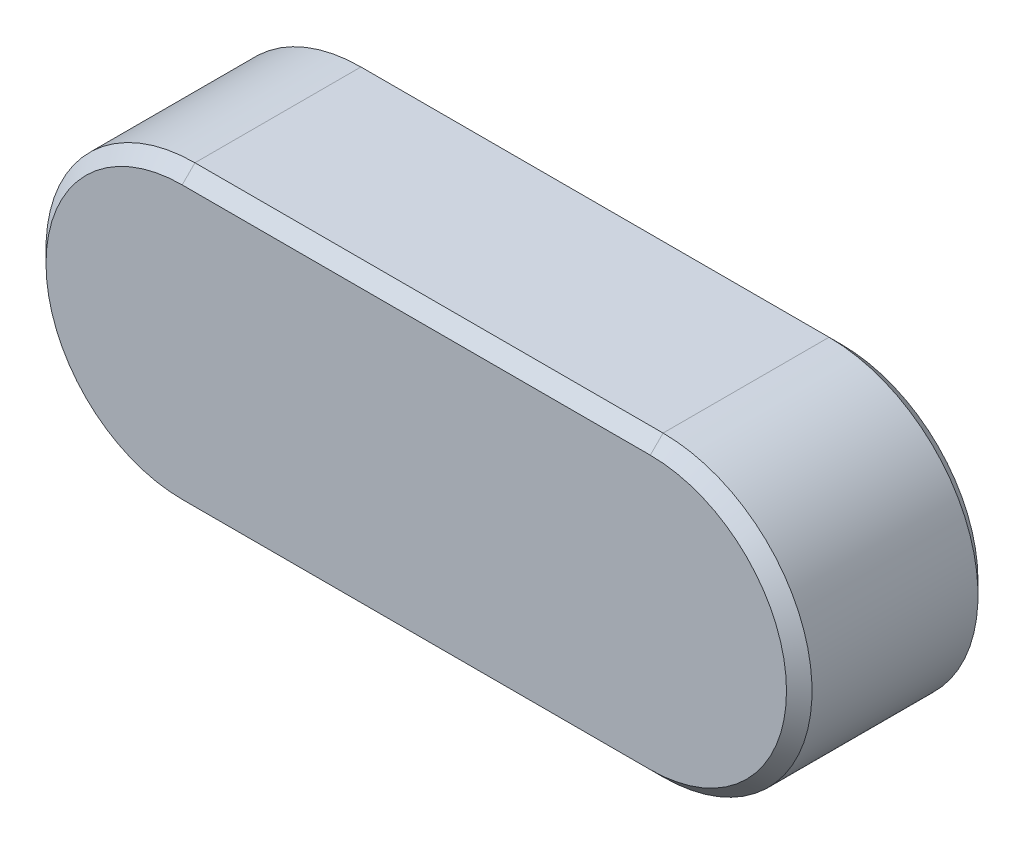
SolidWorks part; units mm, degrees
ref_plane "Front" through (0, 0, 0) normal (0, 0, 1) x (1, 0, 0)
ref_plane "Top" through (0, 0, 0) normal (0, 1, 0) x (1, 0, 0)
ref_plane "Right" through (0, 0, 0) normal (1, 0, 0) x (0, 0, -1)
sketch "Sketch1" plane through (0, 0, 0) normal (0, 0, 1) x (1, 0, 0)
  line L0 (-22, 7) -> (0, 7)
  line L1 (0, -7) -> (-22, -7)
  arc A0 (0, 7) -> (0, -7) centre (0, 0) cw
  arc A1 (-22, -7) -> (-22, 7) centre (-22, 0) cw
  dimension "L" = 36
  dimension "b" = 14
extrude "BaseKey" add sketch "Sketch1" along normal mid plane 9
sketch "Sketch2" plane through (0, 0, 0) normal (0, 0, 1) x (1, 0, 0)
  line L1 (-29, 7) -> (7, 7)
  line L2 (-29, 7) -> (-29, -7)
  line L3 (-29, -7) -> (7, -7)
  line L4 (7, 7) -> (7, -7)
  line L6 (0, -7) -> (-22, -7) construction
  line L7 (-22, 7) -> (0, 7) construction
  arc A2 (0, -7) -> (0, 7) centre (0, 0) ccw construction
  arc A3 (-22, 7) -> (-22, -7) centre (-22, 0) ccw construction
extrude "Extrude1" [suppressed] add sketch "Sketch2" along normal mid plane 9
sketch "Sketch3" plane through (0, 0, 0) normal (0, 0, 1) x (1, 0, 0)
  line L0 (7, 7) -> (-22, 7)
  line L1 (-22, -7) -> (7, -7)
  line L2 (7, -7) -> (7, 7)
  line L5 (-22, 7) -> (0, 7) construction
  arc A0 (-22, 7) -> (-22, -7) centre (-22, 0) ccw
  arc A1 (0, -7) -> (0, 7) centre (0, 0) ccw construction
  arc A4 (-22, 7) -> (-22, -7) centre (-22, 0) ccw construction
extrude "Extrude2" [suppressed] add sketch "Sketch3" along normal mid plane 9
chamfer "Chamfer1" distance 0.6 angle 45 8 edges at (7, 0, -4.5) (-11, -7, -4.5) (-29, 0, -4.5) (-11, 7, -4.5) (-29, 0, 4.5) (-11, -7, 4.5) (7, 0, 4.5) (-11, 7, 4.5)
equation "\"D1@Extrude1\"=\"h@BaseKey\""
equation "\"D1@Extrude2\"=\"h@BaseKey\""
